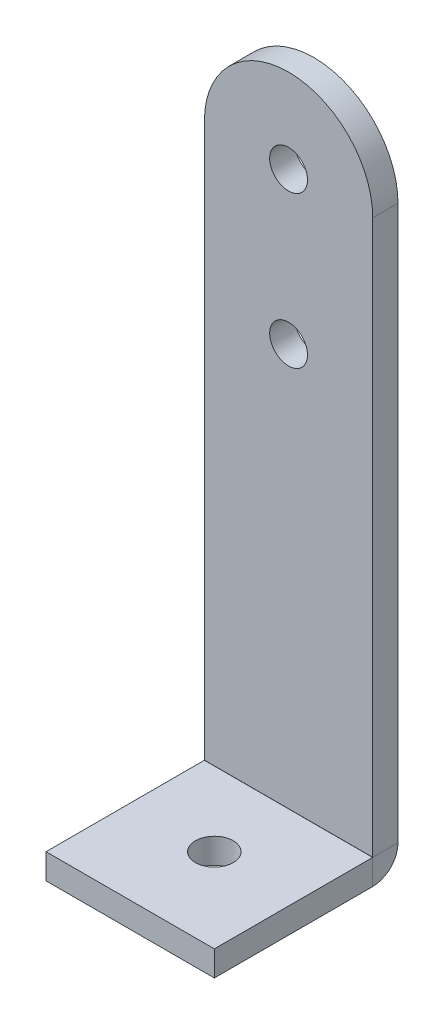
SolidWorks part; units mm, degrees
ref_plane "Front" through (0, 0, 0) normal (0, 0, 1) x (1, 0, 0)
ref_plane "Top" through (0, 0, 0) normal (0, 1, 0) x (1, 0, 0)
ref_plane "Right" through (0, 0, 0) normal (1, 0, 0) x (0, 0, -1)
sketch "Sketch1" plane through (0, 0, 0) normal (0, 0, 1) x (1, 0, 0)
  line L1 (0, 0) -> (20, 0)
  line L2 (0, 0) -> (0, 87)
  line L4 (20, 0) -> (20, 87)
  arc A0 (20, 87) -> (0, 87) centre (10, 87) ccw
  circle A1 centre (10, 69) radius 2.25
  circle A2 centre (10, 87) radius 2.25
  circle A3 centre (10, 10) radius 2.25
sheet metal parameters "Sheet-Metal1" thickness 3 parameters "D1"=0.01
base flange "Base-Flange1" sketch "Sketch1" thickness 3 reverse thickness direction yes parameters "D1"=0.01
sketch "Sketch3" plane through (0, 0, 3) normal (0, 0, 1) x (1, 0, 0)
  line L0 (0, 20) -> (20, 20)
  line L1 (0, 87) -> (0, 0) construction
  line L2 (20, 0) -> (20, 87) construction
sketched bend "Sketched Bend1" parameters "D1"=0.01
bend "SketchBend1" bend radius 0.01 bend angle 90 parameters "D5"=1
flat pattern "Flat-Pattern1"
sketch "Bend-Lines1" plane through (0, 0, 3) normal (0, 0, 1) x (1, 0, 0)
  line L0 (20, 20) -> (0, 20) construction
bend of the flat pattern "Flatten-<SketchBend1>1"
